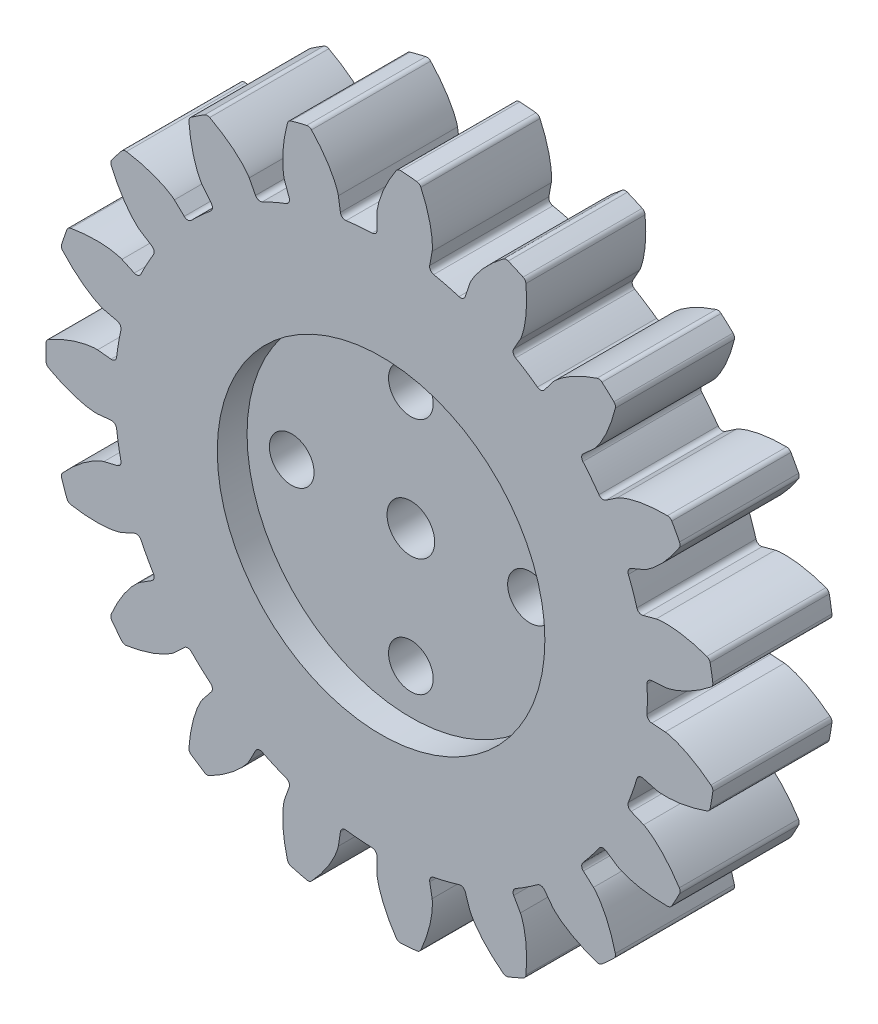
SolidWorks part; units mm, degrees
ref_plane "Front Plane" through (0, 0, 0) normal (0, 0, 1) x (1, 0, 0)
ref_plane "Top Plane" through (0, 0, 0) normal (0, 1, 0) x (1, 0, 0)
ref_plane "Right Plane" through (0, 0, 0) normal (1, 0, 0) x (0, 0, -1)
sketch "Sketch10" plane through (0, 0, 0) normal (0, 0, 1) x (1, 0, 0)
  circle A0 centre (0, 0) radius 22.5
  circle A1 centre (0, 0) radius 1.25
  dimension "D1" = 2.5
  dimension "D2" = 45
extrude "Boss-Extrude5" add sketch "Sketch10" along normal blind 10
sketch "Sketch11" plane through (0, 0, 10) normal (0, 0, 1) x (1, 0, 0)
  line L0 (0, 0) -> (17.88, 0) construction
  line L3 (17.88, 0) -> (22.5005, 0)
  line L4 (0, 0) -> (17.839, 1.2108) construction
  line L5 (19.0859, 1.2954) -> (17.839, 1.2108)
  circle A0 centre (0, 0) radius 17.88 construction
  circle A1 centre (0, 0) radius 19.13 construction
  circle A2 centre (0, 0) radius 20.36 construction
  circle A11 centre (0, 0) radius 22.5005 construction
  arc A12 (22.5005, 0) -> (22.3031, 2.9739) centre (0, 0) ccw
  arc A13 (17.88, 0) -> (17.839, 1.2108) centre (0, 0) ccw
  spline S0 degree 4 poles (19.0859, 1.2954) (19.0913, 1.2959) (19.1065, 1.2973) (19.135, 1.3009) (19.1815, 1.308) (19.2405, 1.3189) (19.3165, 1.335) (19.4057, 1.3566) (19.5032, 1.3831) (19.6089, 1.415) (19.7138, 1.4494) (19.8179, 1.4861) (19.9212, 1.5249) (20.0458, 1.5745) (20.1943, 1.6376) (20.3667, 1.7165) (20.5606, 1.8121) (20.7565, 1.9161) (20.9477, 2.0237) (21.139, 2.1386) (21.3228, 2.254) (21.5117, 2.38) (21.685, 2.4995) (21.8768, 2.6401) (22.0309, 2.7556) (22.2316, 2.915) (22.3493, 3.0113) (22.4861, 3.1265) (22.5464, 3.1789) (22.5835, 3.2111) knots 0 0 0 0 0 0.005377 0.015084 0.028532 0.04661 0.064855 0.092111 0.119476 0.146842 0.174209 0.201575 0.228941 0.256307 0.307035 0.361767 0.4165 0.471232 0.525964 0.580697 0.635429 0.690161 0.744894 0.799626 0.854358 0.909091 0.954545 1 1 1 1 1 construction
  spline S1 degree 4 poles (19.0859, 1.2954) (19.0913, 1.2959) (19.1065, 1.2973) (19.135, 1.3009) (19.1815, 1.308) (19.2405, 1.3189) (19.3165, 1.335) (19.4057, 1.3566) (19.5032, 1.3831) (19.6089, 1.415) (19.7138, 1.4494) (19.8179, 1.4861) (19.9212, 1.5249) (20.0458, 1.5745) (20.1943, 1.6376) (20.3667, 1.7165) (20.5606, 1.8121) (20.7565, 1.9161) (20.9477, 2.0237) (21.139, 2.1386) (21.3228, 2.254) (21.5117, 2.38) (21.685, 2.4995) (21.8768, 2.6401) (22.0309, 2.7556) (22.1881, 2.8805) (22.2643, 2.9421) (22.3031, 2.9739) knots 0 0 0 0 0 0.005377 0.015084 0.028532 0.04661 0.064855 0.092111 0.119476 0.146842 0.174209 0.201575 0.228941 0.256307 0.307035 0.361767 0.4165 0.471232 0.525964 0.580697 0.635429 0.690161 0.744894 0.799626 0.854358 0.909091 0.909091 0.909091 0.909091 0.909091
  dimension "D1" = 40.72
  dimension "D2" = 38.26
  dimension "D3" = 35.76
extrude "Cut-Extrude1" cut sketch "Sketch11" against normal through all
mirror "Mirror1" about plane through (17.88, 0, 0) normal (0, -1, 0) of "Cut-Extrude1"
fillet "Fillet1" radius 0.34 4 edges at (17.839, -1.2108, 5) (22.3026, -2.9735, 5) (22.3026, 2.9735, 5) (17.839, 1.2108, 5)
pattern_circular "CirPattern1" count 19 over 360 about axis through (0, 0, 10) along (0, 0, -1) of "Cut-Extrude1", "Mirror1", "Fillet1"
sketch "Sketch12" plane through (0, 0, 10) normal (0, 0, 1) x (1, 0, 0)
  circle A2 centre (0, 0) radius 11
  dimension "D1" = 22
extrude "Cut-Extrude2" cut sketch "Sketch12" against normal blind 2
sketch "Sketch13" plane through (0, 0, 8) normal (0, 0, 1) x (1, 0, 0)
  circle A0 centre (0, 0) radius 1.6
  dimension "D1" = 3.2
extrude "Cut-Extrude3" cut sketch "Sketch13" against normal through all
sketch "Sketch14" plane through (0, 0, 8) normal (0, 0, 1) x (1, 0, 0)
  line L0 (0, 0) -> (0, 11) construction
  line L1 (0, 0) -> (-11, 0) construction
  line L2 (0, 0) -> (0, -11) construction
  line L3 (0, 0) -> (11, 0) construction
  circle A0 centre (0, 0) radius 11 construction
  circle A1 centre (0, 0) radius 11 construction
  circle A2 centre (0, 8) radius 1.5
  circle A3 centre (8, 0) radius 1.5
  circle A4 centre (0, -8) radius 1.5
  circle A5 centre (-8, 0) radius 1.5
  dimension "D1" = 3
  dimension "D2" = 8
  dimension "D3" = 8
  dimension "D4" = 8
  dimension "D5" = 8
extrude "Cut-Extrude4" cut sketch "Sketch14" against normal blind 6
sketch "Croquis1" plane through (0, 0, 0) normal (0, 0, -1) x (-1, 0, 0)
  line L1 (-29.3017, 25.5972) -> (30.0749, 25.5972)
  line L2 (-29.3017, 25.5972) -> (-29.3017, -25.9289)
  line L3 (-29.3017, -25.9289) -> (30.0749, -25.9289)
  line L4 (30.0749, 25.5972) -> (30.0749, -25.9289)
extrude "Cortar-Extruir1" cut sketch "Croquis1" against normal blind 2
equation "\"P\"= 0.466657"
equation "\"z\"= 19"
equation "\"α\"= 20"
equation "\"s\"= 5"
equation "\"D_b\"= 2.5"
equation "\"c\"= 0.157 / \"P\""
equation "\"D_p\"= \"z\" / \"P\""
equation "\"D_base\"= \"D_p\" * cos ( \"α\" )"
equation "\"h_a\"= 1 / \"P\""
equation "\"h_d\"= 1 / \"P\" + \"c\""
equation "\"P_c\"= pi / \"P\""
equation "\"D_a\"= \"D_p\" + ( 2 * \"h_a\" )"
equation "\"D_d\"= \"D_p\" - ( 2 * \"h_d\" )"
equation "\"φ\"= 360 / \"z\""
equation "\"α_inv\"= ( ( \"D_p\" ^ 2 - \"D_base\" ^ 2 ) ^ 0.5 / \"D_base\" ) * 180 / pi - \"α\""
equation "\"β_inv\"= ( \"φ\" / 4 ) - \"α_inv\""
equation "\"ζ\"= ( ( \"D_a\" / 2 ) ^ 2 - ( \"D_base\" / 2 ) ^ 2 ) ^ 0.5 * 2 / \"D_base\""
